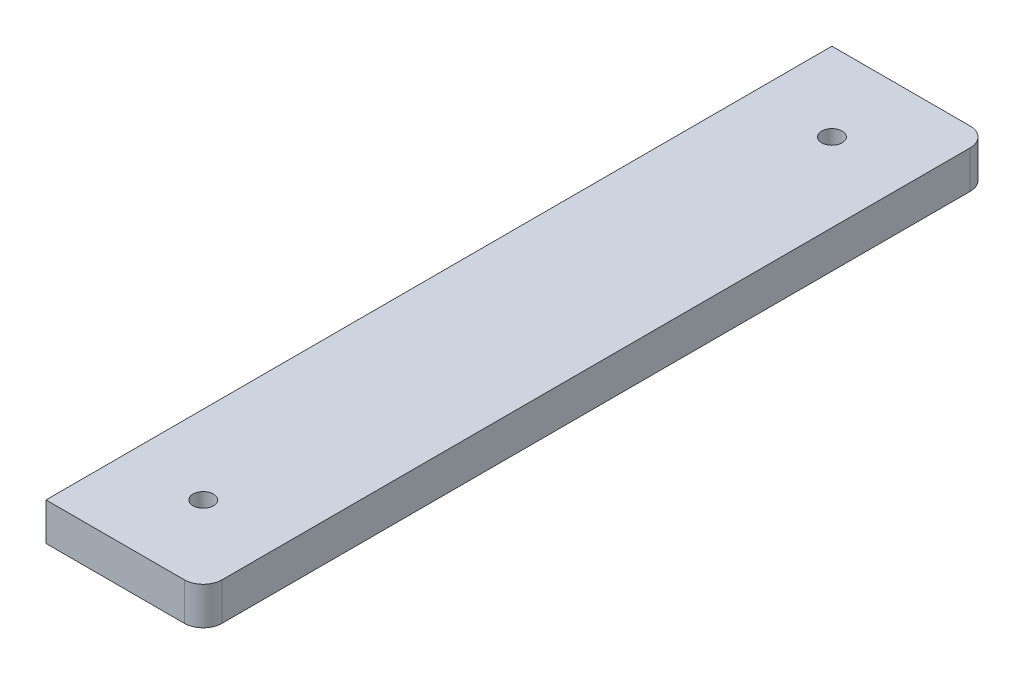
SolidWorks part; units mm, degrees
ref_plane "Front Plane" through (0, 0, 0) normal (0, 0, 1) x (1, 0, 0)
ref_plane "Top Plane" through (0, 0, 0) normal (0, 1, 0) x (1, 0, 0)
ref_plane "Right Plane" through (0, 0, 0) normal (1, 0, 0) x (0, 0, -1)
sketch "Sketch1" plane through (0, 0, 0) normal (0, 1, 0) x (1, 0, 0)
  line L1 (0, 0) -> (50, 0)
  line L2 (0, 0) -> (0, 250)
  line L3 (0, 250) -> (50, 250)
  line L4 (50, 0) -> (50, 250)
  dimension "D1" = 50
  dimension "D2" = 250
extrude "Boss-Extrude1" add sketch "Sketch1" along normal blind 12
fillet "Fillet1" radius 6 2 edges at (50, 6, -250) (50, 6, 0)
sketch "Sketch2" plane through (0, 12, 0) normal (0, 1, 0) x (1, 0, 0)
  line L0 (50, 6) -> (50, 244) construction
  line L1 (44, 250) -> (0, 250) construction
  circle A0 centre (25, 225) radius 3.25
  circle A1 centre (25, 25) radius 3.25
  dimension "D1" = 6.5
  dimension "D2" = 25
  dimension "D3" = 25
  dimension "D4" = 200
  dimension "D5" = 25
extrude "Cut-Extrude1" cut sketch "Sketch2" against normal blind 12
